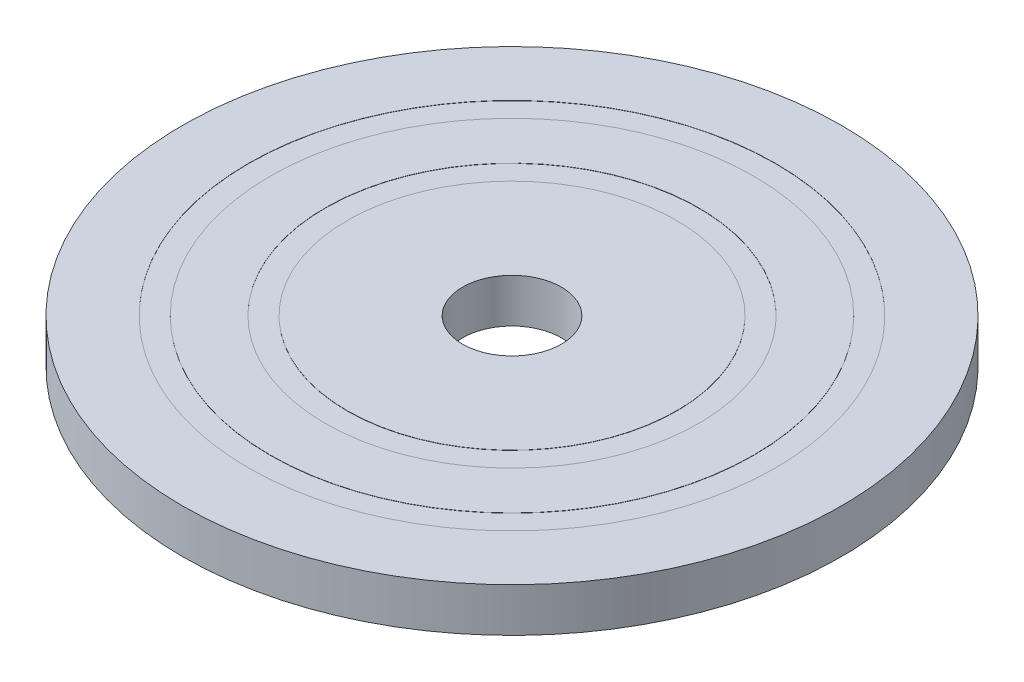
SolidWorks part; units mm, degrees
ref_plane "Front Plane" through (0, 0, 0) normal (0, 0, 1) x (1, 0, 0)
ref_plane "Top Plane" through (0, 0, 0) normal (0, 1, 0) x (1, 0, 0)
ref_plane "Right Plane" through (0, 0, 0) normal (1, 0, 0) x (0, 0, -1)
sketch "Sketch1" plane through (0, 0, 0) normal (0, 1, 0) x (1, 0, 0)
  circle A0 centre (0, 0) radius 2.25
  circle A1 centre (0, 0) radius 15
  dimension "D1" = 4.5
  dimension "D2" = 30
extrude "Extrude1" add sketch "Sketch1" along normal blind 2
sketch "Sketch2" plane through (0, 2, 0) normal (0, 1, 0) x (1, 0, 0)
  circle A0 centre (0, 0) radius 7.5
  circle A1 centre (0, 0) radius 8.5
  circle A2 centre (0, 0) radius 11
  circle A3 centre (0, 0) radius 12
  dimension "D1" = 1
  dimension "D2" = 1
  dimension "D3" = 15
  dimension "D4" = 22
extrude "Extrude2" cut sketch "Sketch2" against normal blind 0.01 contours A3 A2 | A1 A0
